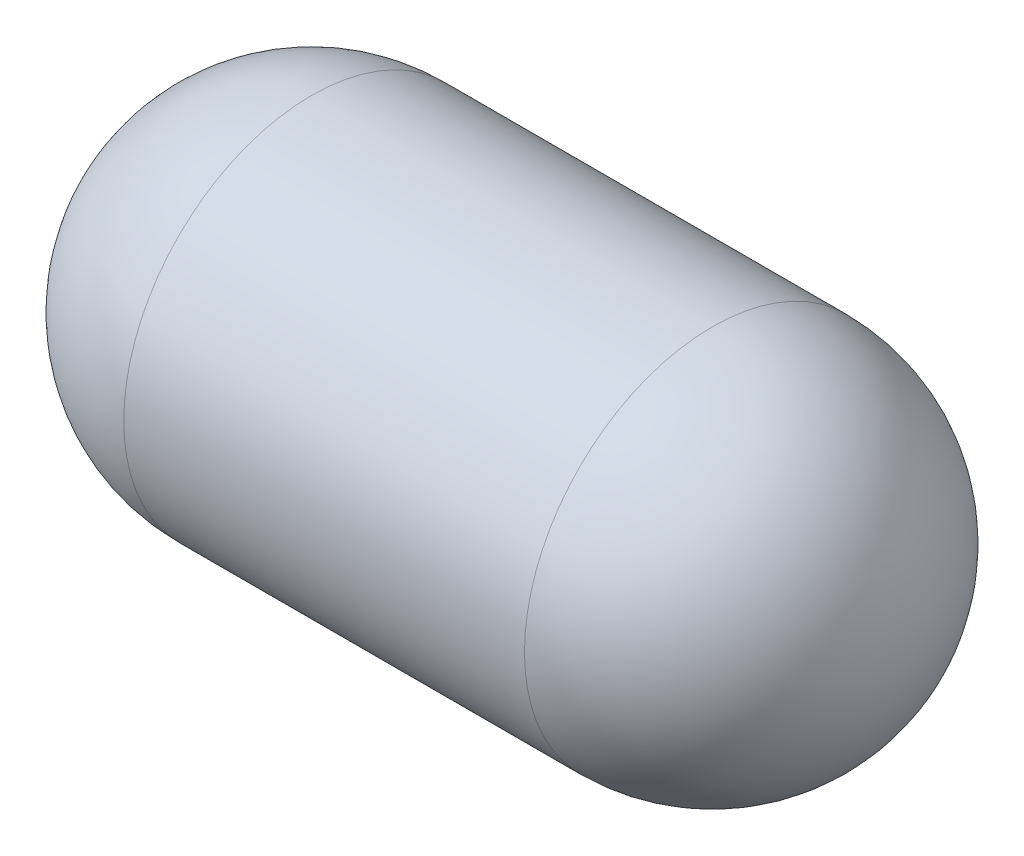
SolidWorks part; units mm, degrees
ref_plane "Front Plane" through (0, 0, 0) normal (0, 0, 1) x (1, 0, 0)
ref_plane "Top Plane" through (0, 0, 0) normal (0, 1, 0) x (1, 0, 0)
ref_plane "Right Plane" through (0, 0, 0) normal (1, 0, 0) x (0, 0, -1)
sketch "Sketch1" plane through (0, 0, 0) normal (0, 0, 1) x (1, 0, 0)
  line L0 (-80, 75) -> (80, 75)
  line L1 (-138.1478, 0) -> (139.3119, 0) construction
  arc A0 (-80, 75) -> (-155, 0) centre (-80, 0) ccw
  arc A1 (80, 75) -> (155, 0) centre (80, 0) cw
  dimension "D2" = 75
  dimension "D3" = 75
  dimension "D1" = 160
  dimension "D4" = 80
  dimension "D5" = 150
revolve "Revolve-Thin1" add sketch "Sketch1" angle 360 about L1
sketch "Sketch3" plane through (0, 0, 0) normal (1, 0, 0) x (0, 0, -1)
  line L0 (0, 86.2745) -> (0, 0)
  line L1 (0, 0) -> (99.4553, 0)
extrude "1/4 Symmetry Model" [suppressed] cut sketch "Sketch3" against normal through all and the other way through all flip side to cut
sketch "Sketch5" plane through (0, 0, 0) normal (0, 0, 1) x (1, 0, 0)
  line L0 (0, 0) -> (0, 113.5648)
extrude "1/8 Symmetry Model" [suppressed] cut sketch "Sketch5" against normal through all and the other way through all
